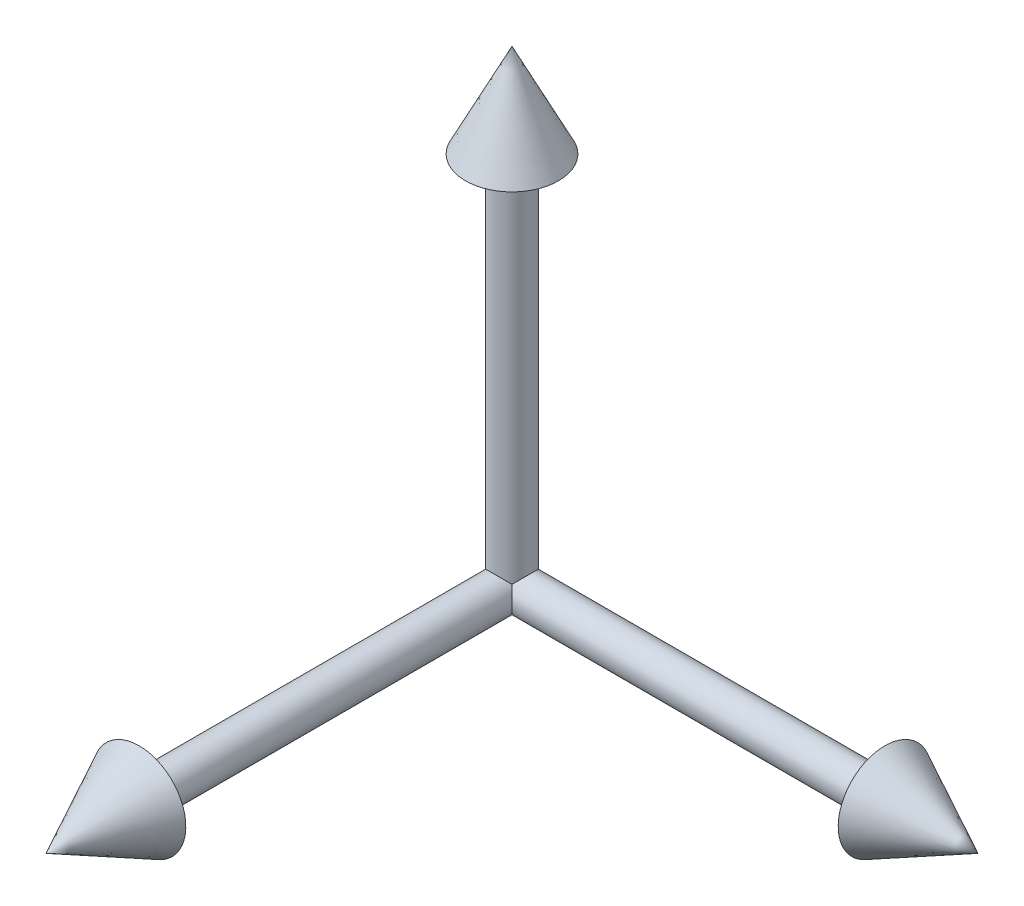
SolidWorks part; units mm, degrees
ref_plane "Plan de face" through (0, 0, 0) normal (0, 0, 1) x (1, 0, 0)
ref_plane "Plan de dessus" through (0, 0, 0) normal (0, 1, 0) x (1, 0, 0)
ref_plane "Plan de droite" through (0, 0, 0) normal (1, 0, 0) x (0, 0, -1)
sketch "Esquisse1" plane through (0, 0, 0) normal (0, 0, 1) x (1, 0, 0)
  line L0 (0, 0) -> (140.3102, 0) construction
  line L1 (200, 10) -> (200, 25)
  line L2 (0, 0) -> (140.3102, 0)
  line L3 (0, 0) -> (0, 10)
  line L4 (0, 10) -> (200, 10)
  line L6 (200, 25) -> (250, 0)
  line L7 (250, 0) -> (140.3102, 0)
  dimension "D1" = 10
  dimension "D2" = 200
  dimension "D3" = 50
  dimension "D4" = 25
revolve "Révolution1" add sketch "Esquisse1" angle 360 about L0
sketch "Esquisse2" plane through (0, 0, 0) normal (0, 0, 1) x (1, 0, 0)
  line L0 (0, 10) -> (0, -10) construction
  line L1 (0, 0) -> (10, 0)
  line L2 (0, 0) -> (0, 200)
  line L4 (10, 0) -> (10, 200)
  line L5 (0, 200) -> (0, 250)
  line L6 (0, 250) -> (25, 200)
  line L7 (25, 200) -> (10, 200)
  dimension "D1" = 10
  dimension "D2" = 200
  dimension "D3" = 50
  dimension "D4" = 25
revolve "Révolution2" add sketch "Esquisse2" angle 360 about L2
sketch "Esquisse3" plane through (0, 0, 0) normal (1, 0, 0) x (0, 0, -1)
  line L0 (-200, 10) -> (-200, 25)
  line L1 (0, 0) -> (-200, 0)
  line L2 (0, 0) -> (0, 10)
  line L3 (0, 10) -> (-200, 10)
  line L5 (-200, 25) -> (-250, 0)
  line L6 (-250, 0) -> (-200, 0)
  dimension "D1" = 10
  dimension "D2" = 200
  dimension "D3" = 50
  dimension "D4" = 25
revolve "Révolution3" add sketch "Esquisse3" angle 360 about L1
